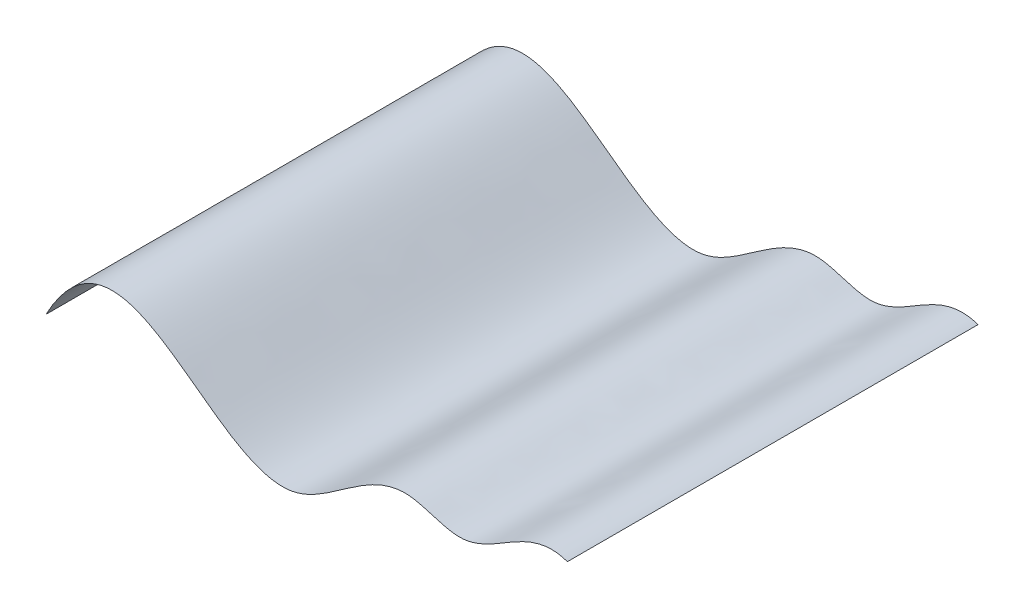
SolidWorks part; units mm, degrees
ref_plane "Front Plane" through (0, 0, 0) normal (0, 0, 1) x (1, 0, 0)
ref_plane "Top Plane" through (0, 0, 0) normal (0, 1, 0) x (1, 0, 0)
ref_plane "Right Plane" through (0, 0, 0) normal (1, 0, 0) x (0, 0, -1)
sketch "Sketch1" plane through (0, 0, 0) normal (0, 0, 1) x (1, 0, 0)
  spline S0 degree 3 poles (-65.5527, -18.7999) (-46.6167, 16.5679) (-14.9997, -51.4912) (17.5011, -6.9758) (42.2009, -20.7286) (53.371, -3.7091) (63.4622, -7.2907) knots 0 0 0 0 0.48737 0.708625 0.800893 1 1 1 1
surface "Surface-Extrude1" sketch "Sketch1" parameters "D1"=101.6
sketch3d "3DSketch1"
  spline S0 degree 3 poles (-29.3303, -24.2539, -82.5969) (-65.8628, 9.2778, -8.5853) (-9.7968, -39.2948, -65.4892) (12.8647, -8.5304, -35.3232) (50.3249, -16.8562, -16.9339) (57.9732, -6.396, -72.8857) (12.6595, -16.2681, -81.7324) (-29.3303, -24.2539, -82.5969) (-65.8628, 9.2778, -8.5853) (-9.7968, -39.2948, -65.4892) knots -0.469855 -0.322068 -0.178992 0 0.170108 0.309299 0.395091 0.530145 0.677932 0.821008 1 1.170108 1.309299 1.395091 only from (-49.1727, -5.4985, -31.7449) to (-49.1727, -5.4985, -31.7449)
ref_plane "Plane1" through (0, 25.4, 0) normal (0, 1, 0) x (1, 0, 0)
sketch "Sketch2" plane through (0, 25.4, 0) normal (0, 1, 0) x (1, 0, 0)
  spline S0 degree 3 poles (-44.7369, 80.241) (-26.9621, 41.7878) (28.8378, 103.3725) (59.5224, 62.572) (28.0058, -11.4945) (-20.9352, 58.1812) (-41.9181, 21.9854) knots 0 0 0 0 0.255998 0.304485 0.610521 1 1 1 1
sketch3d "3DSketch4"
  spline S0 degree 3 poles (-5.9366, -35.767, -88.202) (-31.5426, -9.5584, -69.3635) (-62.0756, -2.2878, -41.709) (-22.0294, -15.8633, -11.7954) (-16.5655, -32.3192, -85.6771) (27.4513, -9.6465, 8.0032) (50.5694, -12.9988, -71.6205) (-5.9366, -35.767, -88.202) (-31.5426, -9.5584, -69.3635) (-62.0756, -2.2878, -41.709) knots -0.463594 -0.324366 -0.135836 0 0.111085 0.210233 0.33896 0.536406 0.675634 0.864164 1 1.111085 1.210233 1.33896 only from (-35.1968, -10.9963, -65.5541) to (-35.1968, -10.9963, -65.5541)
sketch "Sketch3" plane through (0, 25.4, 0) normal (0, 1, 0) x (1, 0, 0)
  spline S0 degree 3 poles (-33.7991, 25.6973) (-73.8681, 42.7644) (-23.3552, 78.222) (6.6435, 114.0453) (14.3832, 9.3027) (40.4415, 23.8139) knots 0 0 0 0 0.198069 0.503261 1 1 1 1
sketch3d "3DSketch5"
  line L0 (-75.8108, -8.3925, 0) -> (7.0753, 34.7307, 0) construction
  line L1 (7.0753, 34.7307, 0) -> (46.2782, -35.2745, 0) construction
  line L2 (46.2782, -35.2745, 0) -> (79.4607, 20.0296, 0) construction
  spline S0 degree 3 poles (-4.7564, -36.4169, -36.6204) (-44.1874, -2.8685, -19.4312) (-56.0701, -1.1272, -70.4417) (-23.7203, -17.2378, -88.3015) (-18.2013, -28.7049, -46.9813) (15.712, -9.1917, -83.0221) (50.9118, -17.2326, -53.7608) (27.7253, -7.3224, -14.4187) (-4.7564, -36.4169, -36.6204) (-44.1874, -2.8685, -19.4312) (-56.0701, -1.1272, -70.4417) knots -0.408514 -0.288772 -0.161705 0 0.151329 0.242255 0.327724 0.470206 0.591486 0.711228 0.838295 1 1.151329 1.242255 1.327724 only from (-40.09, -8.0851, -32.8367) to (-40.09, -8.0851, -32.8367)
  spline_without_curve S2
